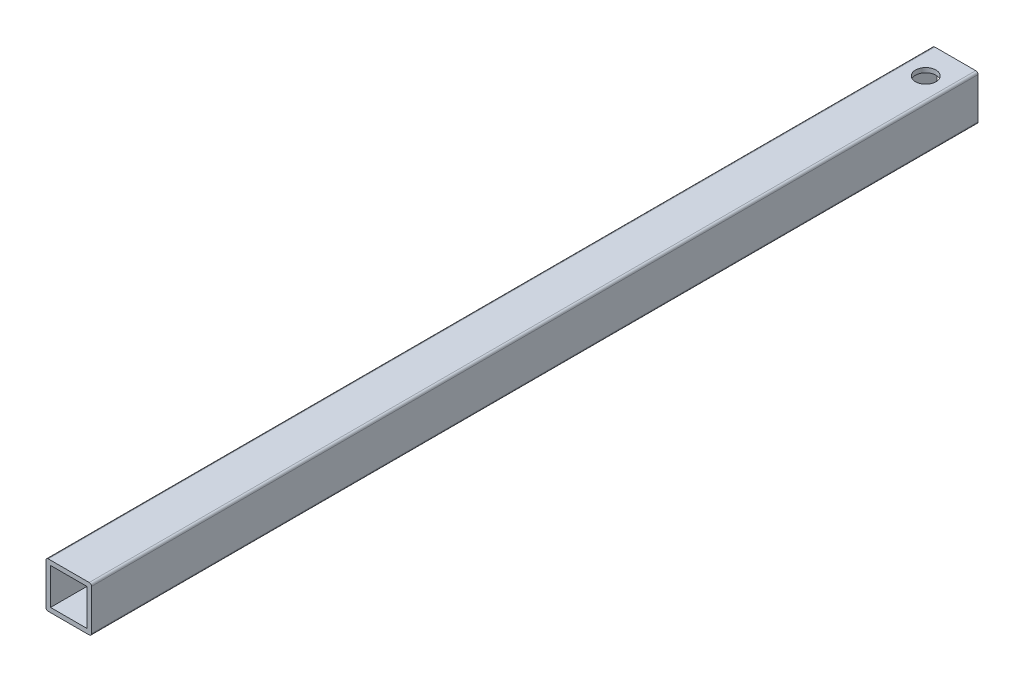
SolidWorks part; units mm, degrees
ref_plane "Plan1" through (0, 0, 0) normal (0, 0, 1) x (1, 0, 0)
ref_plane "Plan2" through (0, 0, 0) normal (0, 1, 0) x (1, 0, 0)
ref_plane "Plan3" through (0, 0, 0) normal (1, 0, 0) x (0, 0, -1)
sketch "Esquisse1" plane through (0, 0, 0) normal (0, 0, 1) x (1, 0, 0)
  line L0 (-9, 10) -> (9, 10)
  line L1 (-10, 9) -> (-10, -9)
  line L2 (9, -10) -> (-9, -10)
  line L3 (10, -9) -> (10, 9)
  line L4 (9, 9) -> (-9, -9) construction
  arc A0 (-9, -10) -> (-10, -9) centre (-9, -9) cw
  arc A1 (-10, 9) -> (-9, 10) centre (-9, 9) cw
  arc A2 (10, 9) -> (9, 10) centre (9, 9) ccw
  arc A3 (10, -9) -> (9, -10) centre (9, -9) cw
  dimension "D1" = 1
  dimension "D2" = 20
extrude "Base-Extru.-Mince" add sketch "Esquisse1" along normal blind 390 thin
sketch "Esquisse2" plane through (0, 10, 0) normal (0, 1, 0) x (-1, 0, 0)
  circle A0 centre (0, 13) radius 4.5
  dimension "D2" = 9
  dimension "D1" = 13
extrude "Enlèv. mat.-Extru.1" cut sketch "Esquisse2" against normal through all
